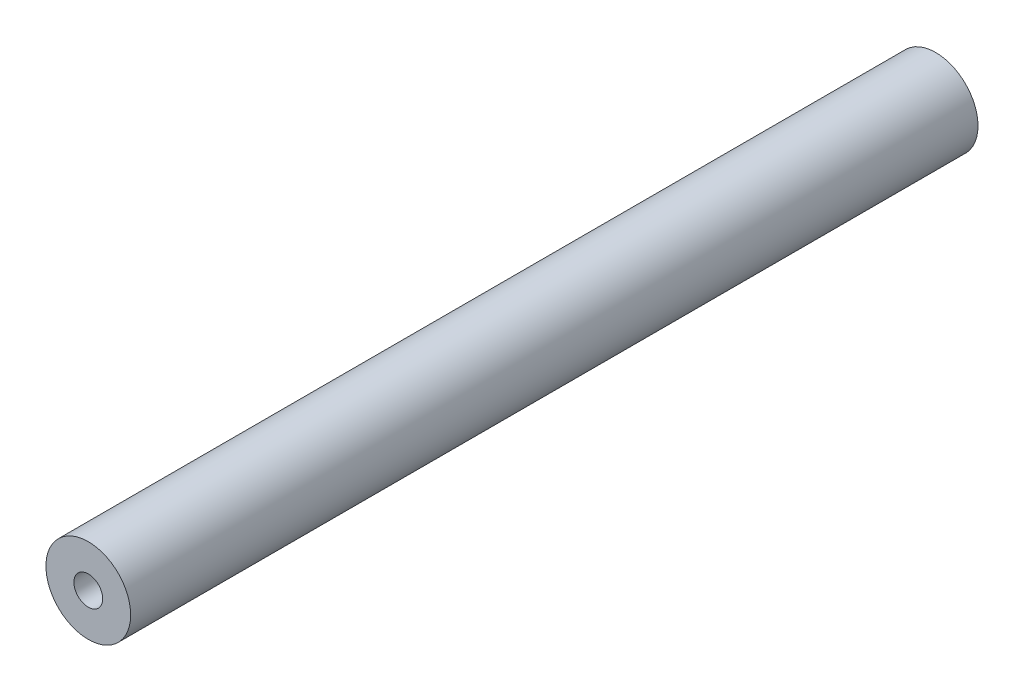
SolidWorks part; units mm, degrees
ref_plane "前基準面" through (0, 0, 0) normal (0, 0, 1) x (1, 0, 0)
ref_plane "上基準面" through (0, 0, 0) normal (0, 1, 0) x (1, 0, 0)
ref_plane "右基準面" through (0, 0, 0) normal (1, 0, 0) x (0, 0, -1)
sketch "草圖1" plane through (0, 0, 0) normal (0, 0, 1) x (1, 0, 0)
  circle A0 centre (0, 0) radius 10
  dimension "D1" = 20
extrude "填料-伸長1" add sketch "草圖1" along normal blind 200
sketch "草圖2" plane through (0, 0, 0) normal (0, 0, -1) x (-1, 0, 0)
  point P0 (0, 0)
hole_wizard "M8 螺紋孔1" positions "草圖4" profile "草圖3" tap size "M8" standard "ISO"
sketch "草圖4" plane through (0, 0, 0) normal (0, 0, -1) x (-1, 0, 0)
  point P0 (0, 0)
sketch "草圖3" plane through (0, 0, 0) normal (1, 0, 0) x (0, 1, 0)
  line L0 (0, 0) -> (0, 21.7929)
  line L1 (0, 21.7929) -> (3.4, 19.75)
  line L2 (3.4, 19.75) -> (3.4, 0)
  line L5 (3.4, 0) -> (0, 0)
  line L10 (0, 21.7929) -> (-3.4, 19.75) construction
  line L11 (0, -6.35) -> (0, 107.95) construction
  dimension "螺孔鑽直徑" = 6.8
  dimension "螺孔鑽深度" = 19.75
  dimension "導頭角度" = 118
hole_wizard "M8 螺紋孔2" positions "草圖6" profile "草圖5" tap size "M8" standard "ISO"
sketch "草圖6" plane through (0, 0, 200) normal (0, 0, 1) x (1, 0, 0)
  point P0 (0, 0)
sketch "草圖5" plane through (0, 0, 200) normal (1, 0, 0) x (0, -1, 0)
  line L0 (0, 0) -> (0, 21.7929)
  line L1 (0, 21.7929) -> (3.4, 19.75)
  line L2 (3.4, 19.75) -> (3.4, 0)
  line L5 (3.4, 0) -> (0, 0)
  line L10 (0, 21.7929) -> (-3.4, 19.75) construction
  line L11 (0, -6.35) -> (0, 107.95) construction
  dimension "螺孔鑽直徑" = 6.8
  dimension "螺孔鑽深度" = 19.75
  dimension "導頭角度" = 118
